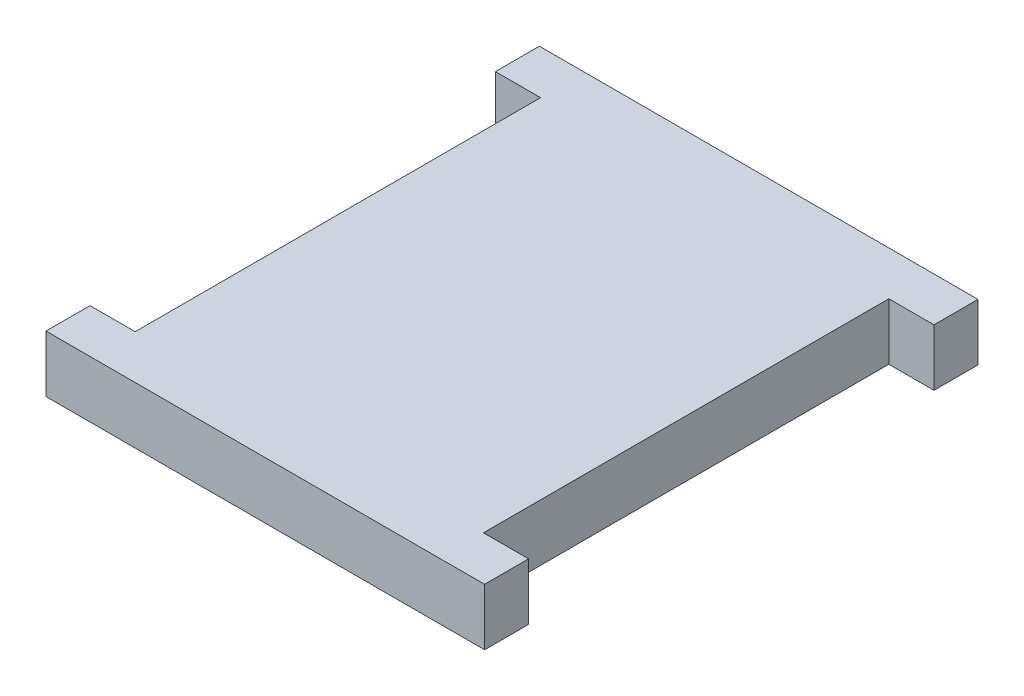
SolidWorks part; units mm, degrees
ref_plane "Front Plane" through (0, 0, 0) normal (0, 0, 1) x (1, 0, 0)
ref_plane "Top Plane" through (0, 0, 0) normal (0, 1, 0) x (1, 0, 0)
ref_plane "Right Plane" through (0, 0, 0) normal (1, 0, 0) x (0, 0, -1)
sketch "Sketch1" plane through (0, 0, 0) normal (0, 1, 0) x (1, 0, 0)
  line L0 (-68, 62.85) -> (-54, 62.85)
  line L1 (-68, -76.5) -> (68, -76.5)
  line L2 (-68, -76.5) -> (-68, -62.85)
  line L3 (-68, 76.5) -> (68, 76.5)
  line L4 (68, -76.5) -> (68, -62.85)
  line L5 (-68, -76.5) -> (68, 76.5) construction
  line L6 (-68, 76.5) -> (68, -76.5) construction
  line L7 (-54, 62.85) -> (-54, -62.85)
  line L8 (-54, -62.85) -> (-68, -62.85)
  line L9 (68, 62.85) -> (54, 62.85)
  line L10 (54, 62.85) -> (54, -62.85)
  line L11 (54, -62.85) -> (68, -62.85)
  line L12 (54, 0) -> (-54, 0) construction
  line L13 (-54, 0) -> (-68, 0) construction
  line L14 (54, 0) -> (68, 0) construction
  line L15 (-68, -62.85) -> (-68, 0) construction
  line L16 (-68, 62.85) -> (-68, 76.5)
  line L17 (-68, 0) -> (-68, 62.85) construction
  line L18 (68, 0) -> (68, 62.85) construction
  line L19 (68, 62.85) -> (68, 76.5)
  line L20 (68, -62.85) -> (68, 0) construction
  point P0 (0, 0)
  dimension "D1" = 153
  dimension "D2" = 136
  dimension "D3" = 125.7
  dimension "D4" = 108
extrude "Boss-Extrude1" add sketch "Sketch1" along normal mid plane 17.6
